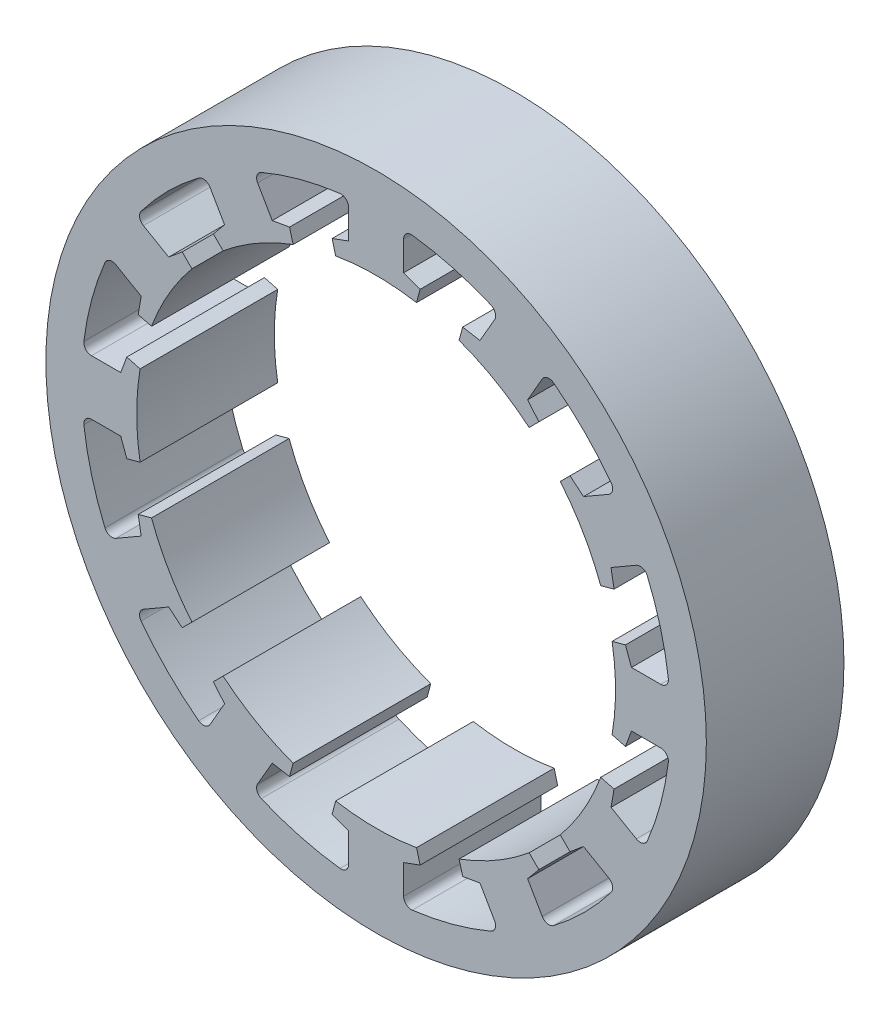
SolidWorks part; units mm, degrees
ref_plane "Front Plane" through (0, 0, 0) normal (0, 0, 1) x (1, 0, 0)
ref_plane "Top Plane" through (0, 0, 0) normal (0, 1, 0) x (1, 0, 0)
ref_plane "Right Plane" through (0, 0, 0) normal (1, 0, 0) x (0, 0, -1)
sketch "Sketch1" plane through (0, 0, 0) normal (0, 0, 1) x (1, 0, 0)
  circle A0 centre (0, 0) radius 60
  dimension "D1" = 120
extrude "Boss-Extrude1" add sketch "Sketch1" along normal blind 25
sketch "Sketch2" plane through (0, 0, 25) normal (0, 0, 1) x (1, 0, 0)
  circle A0 centre (0, 0) radius 43.5
  dimension "D1" = 87
extrude "Cut-Extrude1" cut sketch "Sketch2" against normal through all
sketch "Sketch5" plane through (0, 0, 0) normal (0, 0, 1) x (1, 0, 0)
  line L0 (0, 0) -> (0, 79.2856) construction
  line L1 (0, 0) -> (42.922, 74.3431) construction
  line L2 (42.2782, 30.1828) -> (37.6796, 27.5278)
  line L3 (37.6796, 27.5278) -> (35.2302, 29.5715)
  line L4 (35.2302, 29.5715) -> (31.6947, 26.036)
  line L5 (25.9927, 31.6514) -> (31.6947, 26.036)
  line L6 (29.5715, 35.2302) -> (25.9927, 31.6514)
  line L7 (27.5278, 37.6796) -> (29.5715, 35.2302)
  line L8 (30.1828, 42.2782) -> (27.5278, 37.6796)
  line L9 (5, 51.7054) -> (5, 46.3954) construction
  line L10 (5, 51.7054) -> (5, 46.3954) construction
  line L11 (21.5226, 47.2782) -> (18.8676, 42.6796) construction
  line L12 (5, 51.7054) -> (5, 46.3954)
  line L13 (21.5226, 47.2782) -> (18.8676, 42.6796)
  line L14 (5, 46.3954) -> (7.9946, 45.296)
  line L15 (18.8676, 42.6796) -> (15.7245, 43.2248)
  line L16 (7.9946, 45.296) -> (6.6846, 40.4072)
  line L17 (15.7245, 43.2248) -> (14.4304, 38.3951)
  line L18 (6.6846, 40.4072) -> (14.4304, 38.3951)
  line L19 (51.7054, 5) -> (46.3954, 5)
  line L20 (46.3954, 5) -> (45.296, 7.9946)
  line L21 (45.296, 7.9946) -> (40.4664, 6.7005)
  line L22 (38.336, 14.4146) -> (40.4664, 6.7005)
  line L23 (43.2248, 15.7245) -> (38.336, 14.4146)
  line L24 (42.6796, 18.8676) -> (43.2248, 15.7245)
  line L25 (47.2782, 21.5226) -> (42.6796, 18.8676)
  line L26 (47.2782, -21.5226) -> (42.6796, -18.8676)
  line L27 (42.6796, -18.8676) -> (43.2248, -15.7245)
  line L28 (43.2248, -15.7245) -> (38.3951, -14.4304)
  line L29 (40.4072, -6.6846) -> (38.3951, -14.4304)
  line L30 (45.296, -7.9946) -> (40.4072, -6.6846)
  line L31 (46.3954, -5) -> (45.296, -7.9946)
  line L32 (51.7054, -5) -> (46.3954, -5)
  line L33 (30.1828, -42.2782) -> (27.5278, -37.6796)
  line L34 (27.5278, -37.6796) -> (29.5715, -35.2302)
  line L35 (29.5715, -35.2302) -> (26.036, -31.6947)
  line L36 (31.6514, -25.9927) -> (26.036, -31.6947)
  line L37 (35.2302, -29.5715) -> (31.6514, -25.9927)
  line L38 (37.6796, -27.5278) -> (35.2302, -29.5715)
  line L39 (42.2782, -30.1828) -> (37.6796, -27.5278)
  line L40 (5, -51.7054) -> (5, -46.3954)
  line L41 (5, -46.3954) -> (7.9946, -45.296)
  line L42 (7.9946, -45.296) -> (6.7005, -40.4664)
  line L43 (14.4146, -38.336) -> (6.7005, -40.4664)
  line L44 (15.7245, -43.2248) -> (14.4146, -38.336)
  line L45 (18.8676, -42.6796) -> (15.7245, -43.2248)
  line L46 (21.5226, -47.2782) -> (18.8676, -42.6796)
  line L47 (-21.5226, -47.2782) -> (-18.8676, -42.6796)
  line L48 (-18.8676, -42.6796) -> (-15.7245, -43.2248)
  line L49 (-15.7245, -43.2248) -> (-14.4304, -38.3951)
  line L50 (-6.6846, -40.4072) -> (-14.4304, -38.3951)
  line L51 (-7.9946, -45.296) -> (-6.6846, -40.4072)
  line L52 (-5, -46.3954) -> (-7.9946, -45.296)
  line L53 (-5, -51.7054) -> (-5, -46.3954)
  line L54 (-42.2782, -30.1828) -> (-37.6796, -27.5278)
  line L55 (-37.6796, -27.5278) -> (-35.2302, -29.5715)
  line L56 (-35.2302, -29.5715) -> (-31.6947, -26.036)
  line L57 (-25.9927, -31.6514) -> (-31.6947, -26.036)
  line L58 (-29.5715, -35.2302) -> (-25.9927, -31.6514)
  line L59 (-27.5278, -37.6796) -> (-29.5715, -35.2302)
  line L60 (-30.1828, -42.2782) -> (-27.5278, -37.6796)
  line L61 (-51.7054, -5) -> (-46.3954, -5)
  line L62 (-46.3954, -5) -> (-45.296, -7.9946)
  line L63 (-45.296, -7.9946) -> (-40.4664, -6.7005)
  line L64 (-38.336, -14.4146) -> (-40.4664, -6.7005)
  line L65 (-43.2248, -15.7245) -> (-38.336, -14.4146)
  line L66 (-42.6796, -18.8676) -> (-43.2248, -15.7245)
  line L67 (-47.2782, -21.5226) -> (-42.6796, -18.8676)
  line L68 (-47.2782, 21.5226) -> (-42.6796, 18.8676)
  line L69 (-42.6796, 18.8676) -> (-43.2248, 15.7245)
  line L70 (-43.2248, 15.7245) -> (-38.3951, 14.4304)
  line L71 (-40.4072, 6.6846) -> (-38.3951, 14.4304)
  line L72 (-45.296, 7.9946) -> (-40.4072, 6.6846)
  line L73 (-46.3954, 5) -> (-45.296, 7.9946)
  line L74 (-51.7054, 5) -> (-46.3954, 5)
  line L75 (-30.1828, 42.2782) -> (-27.5278, 37.6796)
  line L76 (-27.5278, 37.6796) -> (-29.5715, 35.2302)
  line L77 (-29.5715, 35.2302) -> (-26.036, 31.6947)
  line L78 (-31.6514, 25.9927) -> (-26.036, 31.6947)
  line L79 (-35.2302, 29.5715) -> (-31.6514, 25.9927)
  line L80 (-37.6796, 27.5278) -> (-35.2302, 29.5715)
  line L81 (-42.2782, 30.1828) -> (-37.6796, 27.5278)
  line L82 (-5, 51.7054) -> (-5, 46.3954)
  line L83 (-5, 46.3954) -> (-7.9946, 45.296)
  line L84 (-7.9946, 45.296) -> (-6.7005, 40.4664)
  line L85 (-14.4146, 38.336) -> (-6.7005, 40.4664)
  line L86 (-15.7245, 43.2248) -> (-14.4146, 38.336)
  line L87 (-18.8676, 42.6796) -> (-15.7245, 43.2248)
  line L88 (-21.5226, 47.2782) -> (-18.8676, 42.6796)
  arc A1 (6.572, 53.0948) -> (5, 51.7054) centre (6.4, 51.7054) ccw
  arc A2 (21.5226, 47.2782) -> (20.8559, 49.2674) centre (20.3101, 47.9782) ccw
  arc A3 (20.8559, 49.2674) -> (6.572, 53.0948) centre (0, 0) ccw
  arc A4 (32.2389, 42.6955) -> (30.1828, 42.2782) centre (31.3953, 41.5782) ccw
  arc A5 (42.6955, 32.2389) -> (32.2389, 42.6955) centre (0, 0) ccw
  arc A6 (42.2782, 30.1828) -> (42.6955, 32.2389) centre (41.5782, 31.3953) ccw
  arc A7 (49.2674, 20.8559) -> (47.2782, 21.5226) centre (47.9782, 20.3101) ccw
  arc A8 (53.0948, 6.572) -> (49.2674, 20.8559) centre (0, 0) ccw
  arc A9 (51.7054, 5) -> (53.0948, 6.572) centre (51.7054, 6.4) ccw
  arc A10 (53.0948, -6.572) -> (51.7054, -5) centre (51.7054, -6.4) ccw
  arc A11 (49.2674, -20.8559) -> (53.0948, -6.572) centre (0, 0) ccw
  arc A12 (47.2782, -21.5226) -> (49.2674, -20.8559) centre (47.9782, -20.3101) ccw
  arc A13 (42.6955, -32.2389) -> (42.2782, -30.1828) centre (41.5782, -31.3953) ccw
  arc A14 (32.2389, -42.6955) -> (42.6955, -32.2389) centre (0, 0) ccw
  arc A15 (30.1828, -42.2782) -> (32.2389, -42.6955) centre (31.3953, -41.5782) ccw
  arc A16 (20.8559, -49.2674) -> (21.5226, -47.2782) centre (20.3101, -47.9782) ccw
  arc A17 (6.572, -53.0948) -> (20.8559, -49.2674) centre (0, 0) ccw
  arc A18 (5, -51.7054) -> (6.572, -53.0948) centre (6.4, -51.7054) ccw
  arc A19 (-6.572, -53.0948) -> (-5, -51.7054) centre (-6.4, -51.7054) ccw
  arc A20 (-20.8559, -49.2674) -> (-6.572, -53.0948) centre (0, 0) ccw
  arc A21 (-21.5226, -47.2782) -> (-20.8559, -49.2674) centre (-20.3101, -47.9782) ccw
  arc A22 (-32.2389, -42.6955) -> (-30.1828, -42.2782) centre (-31.3953, -41.5782) ccw
  arc A23 (-42.6955, -32.2389) -> (-32.2389, -42.6955) centre (0, 0) ccw
  arc A24 (-42.2782, -30.1828) -> (-42.6955, -32.2389) centre (-41.5782, -31.3953) ccw
  arc A25 (-49.2674, -20.8559) -> (-47.2782, -21.5226) centre (-47.9782, -20.3101) ccw
  arc A26 (-53.0948, -6.572) -> (-49.2674, -20.8559) centre (0, 0) ccw
  arc A27 (-51.7054, -5) -> (-53.0948, -6.572) centre (-51.7054, -6.4) ccw
  arc A28 (-53.0948, 6.572) -> (-51.7054, 5) centre (-51.7054, 6.4) ccw
  arc A29 (-49.2674, 20.8559) -> (-53.0948, 6.572) centre (0, 0) ccw
  arc A30 (-47.2782, 21.5226) -> (-49.2674, 20.8559) centre (-47.9782, 20.3101) ccw
  arc A31 (-42.6955, 32.2389) -> (-42.2782, 30.1828) centre (-41.5782, 31.3953) ccw
  arc A32 (-32.2389, 42.6955) -> (-42.6955, 32.2389) centre (0, 0) ccw
  arc A33 (-30.1828, 42.2782) -> (-32.2389, 42.6955) centre (-31.3953, 41.5782) ccw
  arc A34 (-20.8559, 49.2674) -> (-21.5226, 47.2782) centre (-20.3101, 47.9782) ccw
  arc A35 (-6.572, 53.0948) -> (-20.8559, 49.2674) centre (0, 0) ccw
  arc A36 (-5, 51.7054) -> (-6.572, 53.0948) centre (-6.4, 51.7054) ccw
  point P16 (0, 0)
  point P152 (0, 0)
  dimension "D6" = 2.8
  dimension "D7" = 2.8
  dimension "D2" = 53.5
  dimension "D3" = 5
  dimension "D4" = 5
  dimension "D5" = 30
  dimension "D8" = 5.31
  dimension "D9" = 5.31
  dimension "D10" = 110.16
  dimension "D11" = 110.16
  dimension "D12" = 95.16
  dimension "D13" = 95.16
  dimension "D14" = 3.19
  dimension "D15" = 3.19
  dimension "D16" = 8.0029
  dimension "D17" = 5
  dimension "D18" = 6.4
  dimension "D19" = 6.4
  dimension "D20" = 14.4008
  dimension "D21" = 6.572
  dimension "D22" = 12
extrude "Slots-Cut-Extrude" cut sketch "Sketch5" against normal through all and the other way through all
